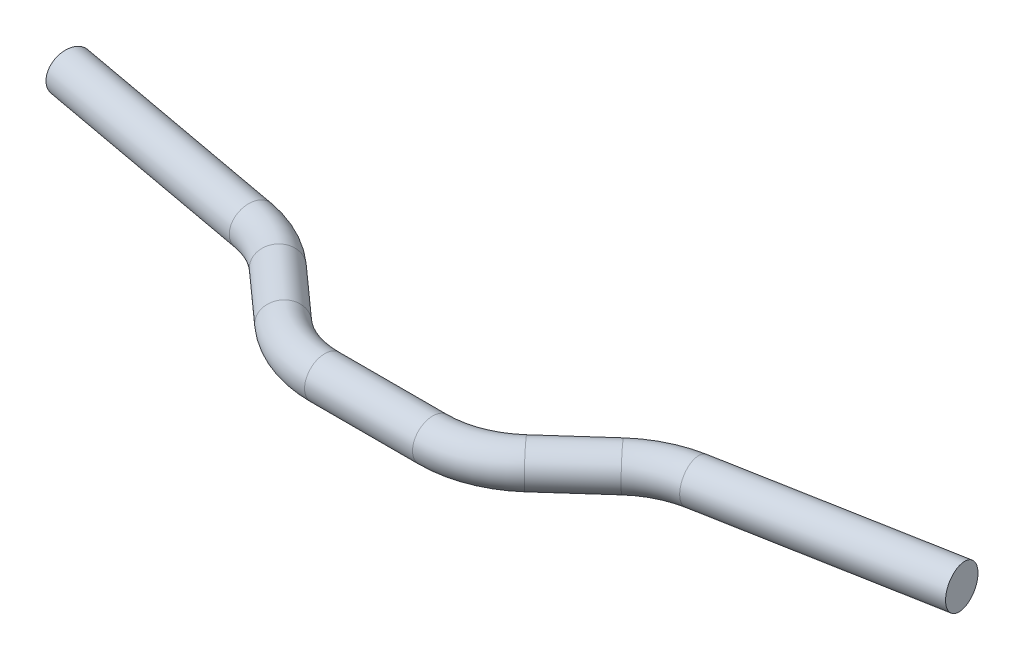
SolidWorks part; units mm, degrees
ref_plane "Alzado" through (0, 0, 0) normal (0, 0, 1) x (1, 0, 0)
ref_plane "Planta" through (0, 0, 0) normal (0, 1, 0) x (1, 0, 0)
ref_plane "Vista lateral" through (0, 0, 0) normal (1, 0, 0) x (0, 0, -1)
sketch "Croquis1" plane through (0, 0, 0) normal (0, 1, 0) x (1, 0, 0)
  line L0 (288.6218, -53.7342) -> (288.6218, 93.6572) construction
  line L1 (-11.3782, 0) -> (-11.3782, 93.6572) construction
  line L2 (553.6218, 93.6572) -> (553.6218, 13.1439) construction
  line L6 (-11.3782, 93.6572) -> (588.6218, 93.6572) construction
  line L7 (588.6218, 93.6572) -> (588.6218, 0) construction
  line L10 (-11.3782, 28.4277) -> (553.6218, 32.0144) construction
  line L12 (420.2259, 3.0523) -> (553.6218, 27.5746)
  line L13 (288.6218, -53.7342) -> (320.682, -53.7342)
  line L15 (391.0456, -11.2629) -> (360.7104, -38.4302)
  arc A0 (420.2259, 3.0523) -> (391.0456, -11.2629) centre (431.074, -55.9588) ccw
  arc A2 (360.7104, -38.4302) -> (320.682, -53.7342) centre (320.682, 6.2658) cw
  dimension "D2" = 60
  dimension "D3" = 60
  dimension "D1" = 600
  dimension "D4" = 35
sketch3d "Croquis3D1"
  circle A0 centre (288.6218, 0, 53.7342) radius 12
  point P2 (300.6218, 0, 53.7342)
sweep "Barrer1" add profiles "Croquis3D1" path "Croquis1"
ref_plane "Plano1" through (288.6218, 0, 0) normal (-1, 0, 0) x (0, 0, 1)
mirror "Simetría1" about plane through (288.6218, 0, 0) normal (-1, 0, 0) of "Barrer1"
